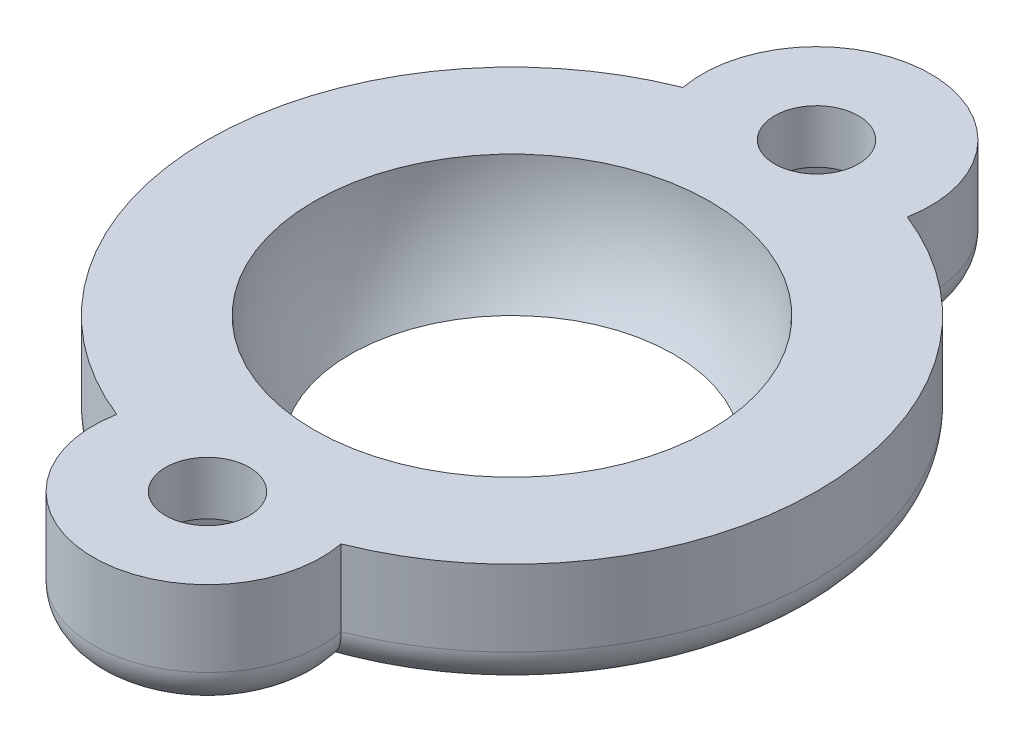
SolidWorks part; units mm, degrees
ref_plane "Plan de face" through (0, 0, 0) normal (0, 0, 1) x (1, 0, 0)
ref_plane "Plan de dessus" through (0, 0, 0) normal (0, 1, 0) x (1, 0, 0)
ref_plane "Plan de droite" through (0, 0, 0) normal (1, 0, 0) x (0, 0, -1)
sketch "Esquisse1" plane through (0, 0, 0) normal (0, 1, 0) x (1, 0, 0)
  line L0 (-40.1999, 39) -> (-66.5855, 39)
  line L1 (-40.1999, 30) -> (-66.5855, 30)
  line L4 (-40.1999, 42.0658) -> (-40.1999, 16.2463) construction
  line L5 (-73.1999, 16.2463) -> (-73.1999, 42.0658) construction
  line L6 (-35.6999, 29.0414) -> (-35.6999, 45.9292) construction
  line L7 (-47.1999, 29.0414) -> (-47.1999, 45.9292) construction
  line L9 (-79.4994, 34.5) -> (-44.5393, 34.5) construction
  line L10 (-73.1999, 24.2483) -> (-71.2499, 25.3742) construction
  line L11 (-71.2499, 25.3742) -> (-71.2499, 27.6258) construction
  line L12 (-71.2499, 27.6258) -> (-73.1999, 28.7517) construction
  line L13 (-73.1999, 28.7517) -> (-75.1499, 27.6258) construction
  line L14 (-75.1499, 27.6258) -> (-75.1499, 25.3742) construction
  line L15 (-75.1499, 25.3742) -> (-73.1999, 24.2483) construction
  arc A0 (-66.5855, 39) -> (-70.2531, 41.9375) centre (-73.1999, 34.5) ccw
  circle A1 centre (-40.1999, 34.5) radius 1.6
  arc A2 (-40.1999, 30) -> (-40.1999, 39) centre (-40.1999, 34.5) ccw
  circle A3 centre (-47.1999, 34.5) radius 1.1
  circle A4 centre (-73.1999, 34.5) radius 5 construction
  circle A5 centre (-73.1999, 26.5) radius 1.1
  arc A6 (-76.1467, 27.0625) -> (-70.2531, 27.0625) centre (-73.1999, 26.5) ccw
  circle A7 centre (-73.1999, 26.5) radius 1.95 construction
  arc A8 (-76.1467, 41.9375) -> (-70.2531, 41.9375) centre (-73.1999, 42.5) cw
  circle A9 centre (-73.1999, 42.5) radius 1.1
  arc A11 (-76.1467, 41.9375) -> (-76.1467, 27.0625) centre (-73.1999, 34.5) ccw
  arc A12 (-70.2531, 27.0625) -> (-66.5855, 30) centre (-73.1999, 34.5) ccw
  dimension "D3" = 11.5
  dimension "D1" = 33
  dimension "D2" = 4.5
extrude "Boss.-Extru.1" add sketch "Esquisse1" along normal blind 5
sketch "Esquisse2" plane through (0, 5, 0) normal (0, 1, 0) x (1, 0, 0)
  line L2 (-40.1999, 31.3246) -> (-37.4499, 32.9123)
  line L3 (-37.4499, 32.9123) -> (-37.4499, 36.0877)
  line L10 (-37.4499, 36.0877) -> (-40.1999, 37.6754)
  line L11 (-40.1999, 37.6754) -> (-42.9499, 36.0877)
  line L12 (-42.9499, 36.0877) -> (-42.9499, 32.9123)
  line L13 (-42.9499, 32.9123) -> (-40.1999, 31.3246)
  circle A1 centre (-40.1999, 34.5) radius 2.8 construction
extrude "Enlèv. mat.-Extru.1" cut sketch "Esquisse2" against normal blind 2.3
sketch "Esquisse15" plane through (0, 0, 0) normal (0, -1, 0) x (1, 0, 0)
  circle A1 centre (-73.1999, -26.5) radius 1.1
  arc A2 (-70.2531, -27.0625) -> (-76.1467, -27.0625) centre (-73.1999, -26.5) ccw
  circle A3 centre (-73.1999, -42.5) radius 1.1
  arc A4 (-76.1467, -41.9375) -> (-70.2531, -41.9375) centre (-73.1999, -42.5) ccw
  arc A5 (-76.1467, -27.0625) -> (-76.1467, -41.9375) centre (-73.1999, -34.5) ccw
  arc A6 (-70.2531, -41.9375) -> (-70.2531, -27.0625) centre (-73.1999, -34.5) ccw
extrude "Boss.-Extru.7" add sketch "Esquisse15" along normal blind 6.5
ref_plane "Plan1" through (0, 0, -34.5) normal (0, 0, 1) x (1, 0, 0)
sketch "Esquisse14" plane through (0, 0, -34.5) normal (0, 0, 1) x (1, 0, 0)
  line L0 (-73.1999, 11.2226) -> (-73.1999, -13.2246) construction
  line L1 (-67.9999, -13.2246) -> (-67.9999, 7.5813) construction
  line L2 (-87.2042, -8.5) -> (-60.2978, -8.5) construction
  line L3 (-87.2042, 0) -> (-60.2978, 0) construction
  line L4 (-40.1999, 0) -> (-66.5855, 0) construction
  line L5 (-83.5014, -3.5) -> (-60.2978, -3.5) construction
  line L6 (-73.1999, 1.7) -> (-73.1999, -8.7)
  line L8 (-81.1999, 5) -> (-81.1999, -13.2246) construction
  arc A0 (-73.1999, -8.7) -> (-73.1999, 1.7) centre (-73.1999, -3.5) ccw
  circle A1 centre (-73.1999, -3.5) radius 5 construction
  dimension "D2" = 5
  dimension "D3" = 8
  dimension "D4" = 5.2
  dimension "D1" = 8.5
revolve "Enlèvement de matière-Révolution4" cut sketch "Esquisse14" angle 360 about L0
sketch "Esquisse19" plane through (0, 0, 0) normal (0, -1, 0) x (1, 0, 0)
  circle A0 centre (-47.1999, -34.5) radius 2.2
extrude "Enlèv. mat.-Extru.8" cut sketch "Esquisse19" against normal blind 2
sketch "Esquisse20" plane through (0, 5, 0) normal (0, 1, 0) x (1, 0, 0)
  circle A0 centre (-73.1999, 26.5) radius 2
  circle A1 centre (-73.1999, 42.5) radius 2
extrude "Enlèv. mat.-Extru.9" cut sketch "Esquisse20" against normal blind 2
sketch "Esquisse21" plane through (0, -6.5, 0) normal (0, -1, 0) x (1, 0, 0)
  line L1 (-71.0059, -26.5) -> (-72.1029, -24.6)
  line L2 (-72.1029, -24.6) -> (-74.2968, -24.6)
  line L3 (-74.2968, -24.6) -> (-75.3938, -26.5)
  line L4 (-75.3938, -26.5) -> (-74.2968, -28.4)
  line L5 (-74.2968, -28.4) -> (-72.1029, -28.4)
  line L6 (-72.1029, -28.4) -> (-71.0059, -26.5)
  line L7 (-71.0059, -42.5) -> (-72.1029, -40.6)
  line L8 (-72.1029, -40.6) -> (-74.2968, -40.6)
  line L9 (-74.2968, -40.6) -> (-75.3938, -42.5)
  line L10 (-75.3938, -42.5) -> (-74.2968, -44.4)
  line L11 (-74.2968, -44.4) -> (-72.1029, -44.4)
  line L12 (-72.1029, -44.4) -> (-71.0059, -42.5)
  circle A0 centre (-73.1999, -26.5) radius 1.9 construction
  circle A1 centre (-73.1999, -42.5) radius 1.9 construction
extrude "Enlèv. mat.-Extru.10" cut sketch "Esquisse21" against normal blind 1.6
sketch "Esquisse22" plane through (0, 0, 0) normal (0, 0, 1) x (1, 0, 0)
  line L1 (-30.9495, -3.5) -> (-82.5752, -3.5) construction
  line L3 (-81.8473, -3.5) -> (-34.9811, -3.5)
  line L4 (-81.8473, -3.5) -> (-81.8473, 5.4589)
  line L5 (-81.8473, 5.4589) -> (-34.9811, 5.4589)
  line L6 (-34.9811, -3.5) -> (-34.9811, 5.4589)
extrude "Enlèv. mat.-Extru.11" cut sketch "Esquisse22" against normal through all
fillet "Congé1" radius 1 4 edges at (-73.1999, -6.5, -45.5) (-81.1999, -6.5, -34.5) (-65.1999, -6.5, -34.5) (-73.1999, -6.5, -23.5)
